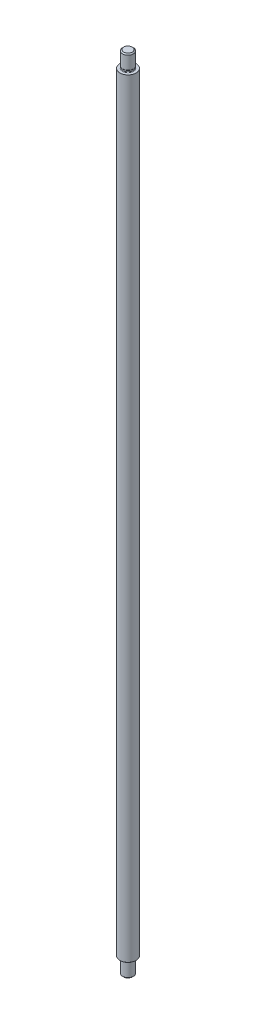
SolidWorks part; units mm, degrees
ref_plane "Спереди" through (0, 0, 0) normal (0, 0, 1) x (1, 0, 0)
ref_plane "Сверху" through (0, 0, 0) normal (0, 1, 0) x (1, 0, 0)
ref_plane "Справа" through (0, 0, 0) normal (1, 0, 0) x (0, 0, -1)
ref_plane "Плоскость1" through (0, 0, 0) normal (0, 0, -1) x (-1, 0, 0)
sketch "Эскиз1" plane through (0, 0, 0) normal (0, 0, -1) x (-1, 0, 0)
  line L0 (-4, -140) -> (0, -140)
  line L1 (0, -140) -> (0, 600)
  line L2 (0, 600) -> (-4, 600)
  line L3 (-4, 600) -> (-5, 599)
  line L4 (-5, 599) -> (-5, 587)
  line L5 (-5, 587) -> (-4.6879, 586.6879)
  line L6 (-4.6, 586.4757) -> (-4.6, 585.5)
  line L7 (-5.1, 585) -> (-7.5, 585)
  line L8 (-7.5, 585) -> (-7.5, -125)
  line L9 (-7.5, -125) -> (-5.1, -125)
  line L10 (-4.6, -125.5) -> (-4.6, -126.4757)
  line L11 (-4.6879, -126.6879) -> (-5, -127)
  line L12 (-5, -127) -> (-5, -139)
  line L13 (-5, -139) -> (-4, -140)
  line L14 (0, -140) -> (0, 600) construction
  arc A0 (-4.6879, 586.6879) -> (-4.6, 586.4757) centre (-4.9, 586.4757) cw
  arc A1 (-4.6, 585.5) -> (-5.1, 585) centre (-5.1, 585.5) cw
  arc A2 (-5.1, -125) -> (-4.6, -125.5) centre (-5.1, -125.5) cw
  arc A3 (-4.6, -126.4757) -> (-4.6879, -126.6879) centre (-4.9, -126.4757) cw
  point P23 (0, 0)
  dimension "D1" = 12
  dimension "D2" = 710
  dimension "D3" = 12
  dimension "D4" = 740
revolve "Повернуть1" add sketch "Эскиз1" angle 360 about L14
